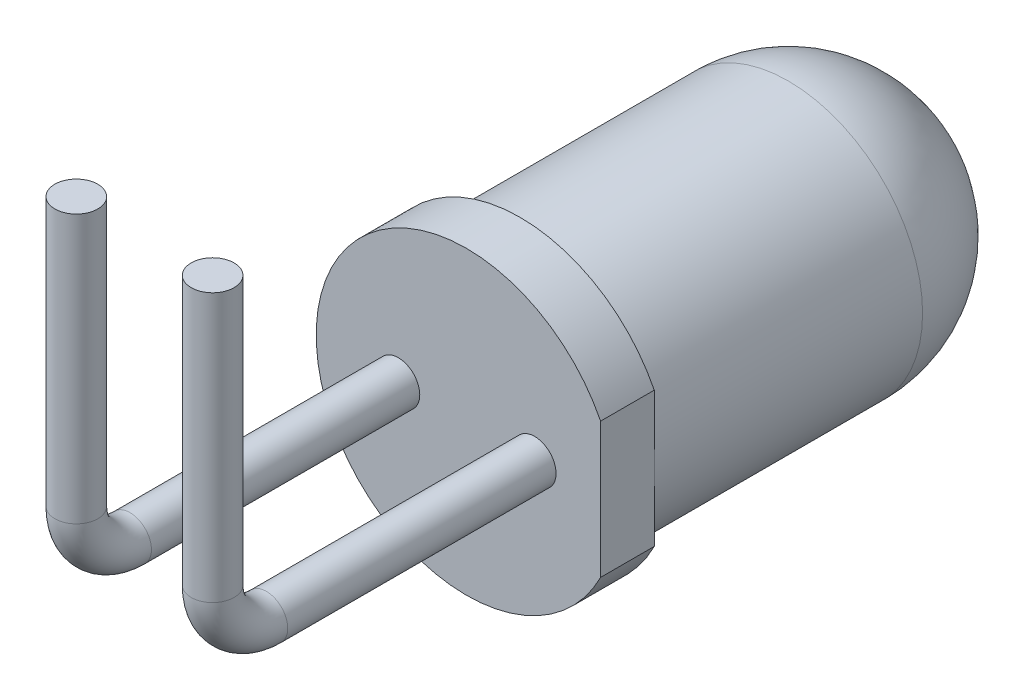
SolidWorks part; units mm, degrees
ref_plane "Face" through (0, 0, 0) normal (0, 0, 1) x (1, 0, 0)
ref_plane "Dessus" through (0, 0, 0) normal (0, 1, 0) x (1, 0, 0)
ref_plane "Droite" through (0, 0, 0) normal (1, 0, 0) x (0, 0, -1)
sketch "Esquisse1" plane through (0, 0, 0) normal (0, 0, 1) x (1, 0, 0)
  circle A0 centre (0, 0) radius 2.5
extrude "Base-Extrusion" add sketch "Esquisse1" along normal blind 8.5
sketch "Esquisse2" plane through (0, 0, 8.5) normal (0, 0, 1) x (1, 0, 0)
  line L0 (2.5, -2.4917) -> (2.5, 2.5621) construction
  line L1 (2.5, 1.261) -> (2.5, -1.261)
  arc A0 (2.5, 1.261) -> (2.5, -1.261) centre (0, 0) ccw
extrude "Boss.-Extru.1" add sketch "Esquisse2" against normal blind 1
fillet "Congé1" radius 2.5 1 edges at (2.5, 0, 0)
sketch "Esquisse3" plane through (0, 0, 8.5) normal (0, 0, 1) x (1, 0, 0)
  line L0 (2.8791, 0) -> (-3.5821, 0) construction
  line L1 (0, -2.9335) -> (0, 2.9813) construction
  line L2 (1.27, -0.8777) -> (1.27, 1.5607) construction
  circle A0 centre (1.27, 0) radius 0.4
  dimension "D1" = 1.27
ref_plane "Plan1" through (1.27, 0, 0) normal (1, 0, 0) x (0, 0, -1)
sketch "Esquisse5" plane through (1.27, 0, 0) normal (1, 0, 0) x (0, 0, -1)
  line L0 (-8.5, -5.3883) -> (-8.5, 4.4127) construction
  line L1 (-14.5, 9.2152) -> (-14.5, -2.555) construction
  line L2 (1.3145, 0) -> (-22.6036, 0) construction
  line L3 (-22.6036, 6) -> (-12.2793, 6) construction
  line L4 (-8.5, 0) -> (-13.5, 0)
  line L5 (-14.5, 1) -> (-14.5, 6)
  arc A0 (-13.5, 0) -> (-14.5, 1) centre (-13.5, 1) cw
  dimension "D3" = 1
  dimension "D1" = 6
  dimension "D2" = 6
ref_plane "Plan2" through (0, 0, 0) normal (1, 0, 0) x (0, 0, -1)
sweep "Balayage1" add profiles "Esquisse3" path "Esquisse5"
mirror "Symétrie1" about plane through (0, 0, 0) normal (1, 0, 0) of "Balayage1"
